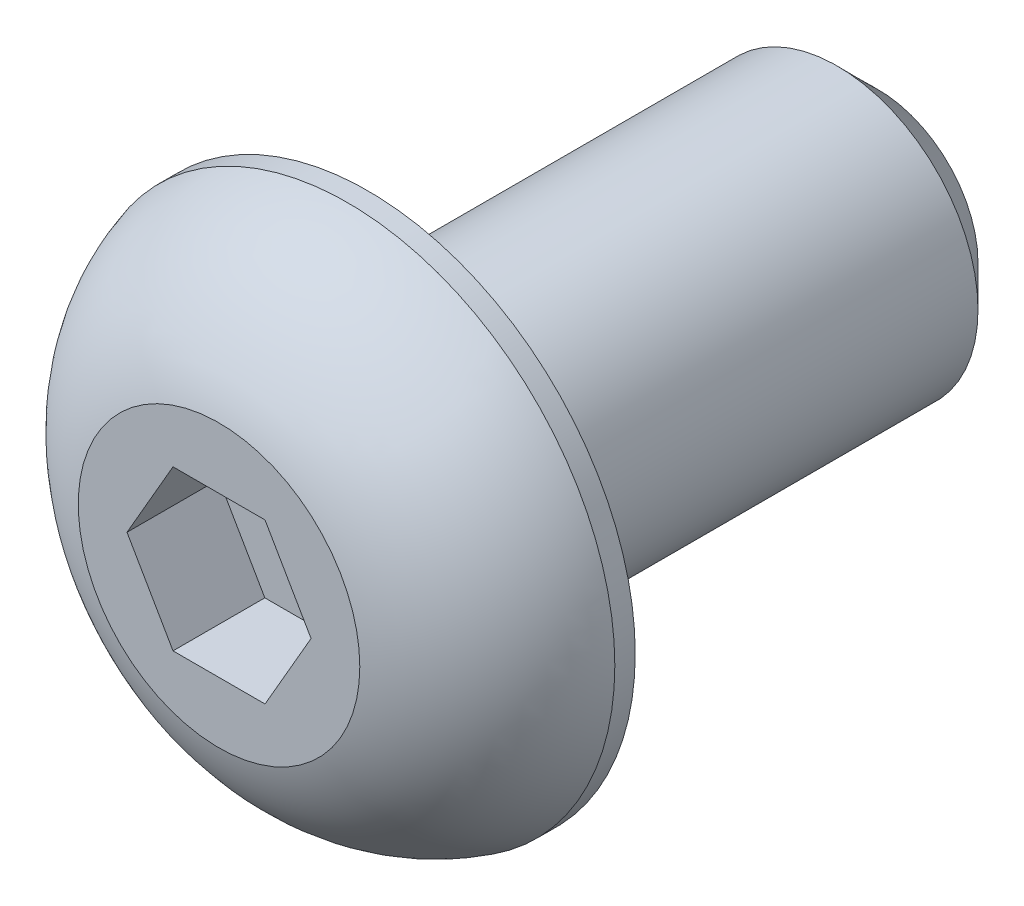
SolidWorks part; units mm, degrees
ref_plane "Front Plane" through (0, 0, 0) normal (0, 0, 1) x (1, 0, 0)
ref_plane "Top Plane" through (0, 0, 0) normal (0, 1, 0) x (1, 0, 0)
ref_plane "Right Plane" through (0, 0, 0) normal (1, 0, 0) x (0, 0, -1)
sketch "Sketch1" plane through (0, 0, 0) normal (1, 0, 0) x (0, 0, -1)
  line L0 (0, 1.7526) -> (0, 3.3274)
  line L1 (-1.8542, 1.7526) -> (-1.8542, 0)
  line L2 (-1.8542, 0) -> (6.35, 0)
  line L3 (6.35, 0) -> (6.35, 1.2446)
  line L4 (5.842, 1.7526) -> (0, 1.7526)
  line L5 (-3.151, 0) -> (7.2489, 0) construction
  line L6 (0, 3.3274) -> (-0.254, 3.3274)
  line L7 (6.35, 1.2446) -> (5.842, 1.7526)
  arc A0 (-0.254, 3.3274) -> (-1.8542, 1.7526) centre (0.3427, 1.1207) ccw
  point P8 (6.35, 1.7526)
  dimension "D4" = 2.286
  dimension "D1" = 3.5052
  dimension "D2" = 6.35
  dimension "D3" = 1.8542
  dimension "D5" = 6.6548
  dimension "D6" = 3.5052
  dimension "D7" = 0.254
revolve "Revolve1" add sketch "Sketch1" angle 360 about L5
sketch "Sketch2" plane through (0, 0, 1.8542) normal (0, 0, 1) x (1, 0, 0)
  line L1 (-0.5728, -0.9922) -> (0.5728, -0.9922)
  line L2 (0.5728, -0.9922) -> (1.1457, 0)
  line L3 (1.1457, 0) -> (0.5728, 0.9922)
  line L4 (0.5728, 0.9922) -> (-0.5728, 0.9922)
  line L5 (-0.5728, 0.9922) -> (-1.1457, 0)
  line L6 (-1.1457, 0) -> (-0.5728, -0.9922)
  circle A0 centre (0, 0) radius 0.9922 construction
  dimension "D1" = 1.9844
extrude "Cut-Extrude1" cut sketch "Sketch2" against normal blind 1.143
